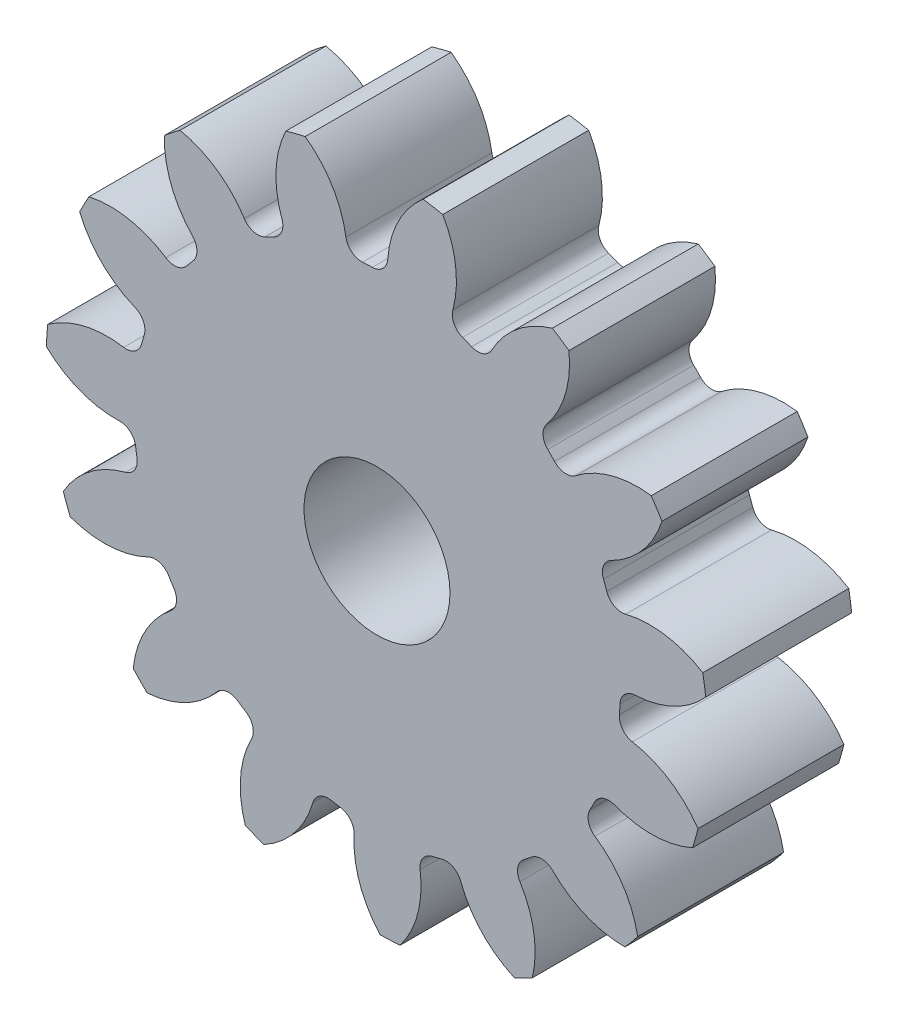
SolidWorks part; units mm, degrees
ref_plane "Front" through (0, 0, 0) normal (0, 0, 1) x (1, 0, 0)
ref_plane "Top" through (0, 0, 0) normal (0, 1, 0) x (1, 0, 0)
ref_plane "Right" through (0, 0, 0) normal (1, 0, 0) x (0, 0, -1)
sketch "Sketch3" plane through (0, 0, 0) normal (0, 0, 1) x (1, 0, 0)
  circle A0 centre (0, 0) radius 287.8667
  dimension "od" = 575.7333
extrude "gearBody" add sketch "Sketch3" along normal blind 127
sketch "Sketch2" plane through (0, 0, 0) normal (0, 0, 1) x (1, 0, 0)
  line L0 (0, 0) -> (220.5133, 91.3396) construction
  line L1 (280.8826, -72.0567) -> (0, 0) construction
  line L2 (0, 0) -> (36.3143, 0) construction
  line L3 (253.8017, 10.0341) -> (250.3432, -42.9451) construction
  line L5 (252.0725, -16.4555) -> (0, 0) construction
  line L7 (0, 0) -> (238.6819, 0) construction
  arc A0 (238.6215, 5.3698) -> (235.8982, -36.3469) centre (0, 0) ccw construction
  arc A1 (285.9957, 32.7669) -> (279.3085, -69.6704) centre (0, 0) ccw construction
  arc A2 (253.8017, 10.0341) -> (250.3432, -42.9451) centre (0, 0) ccw construction
  arc A3 (210.8997, -18.0032) -> (211.4503, -9.5682) centre (0, 0) ccw
  arc A4 (280.8826, -72.0567) -> (222.2105, -32.7446) centre (206.767, -119.2328) ccw
  arc A5 (280.8826, -72.0567) -> (287.8667, 34.9283) centre (0, 0) ccw
  arc A6 (287.8667, 34.9283) -> (224.5817, 3.5777) centre (220.5133, 91.3396) cw
  arc A7 (211.4503, -9.5682) -> (224.5817, 3.5777) centre (225.2199, -10.1913) cw
  arc A8 (222.2105, -32.7446) -> (210.8997, -18.0032) centre (224.6334, -19.1755) cw
  point P6 (287.8667, 34.9283)
  point P22 (280.8826, -72.0567)
  dimension "baseDia" = 477.3639
  dimension "od" = 575.7333
  dimension "pd" = 508
  dimension "rd" = 423.3333
  dimension "rFillet" = 13.7837
  dimension "pointX" = 287.8667
  dimension "pointY" = 34.9283
  dimension "CTT" = 52.9791
  dimension "flankCenterAngle" = 22.5
extrude "toothCut" cut sketch "Sketch2" along normal through all
pattern_circular "CirPattern1" count 15 over 360 about axis through (0, 0, 0) along (0, 0, 1) of "toothCut"
sketch "hub1Dia" plane through (0, 0, 0) normal (0, 0, -1) x (-1, 0, 0)
  circle A0 centre (0, 0) radius 12.7
  dimension "hub1Dia" = 25.4
sketch "hub2Dia" plane through (0, 0, 127) normal (0, 0, 1) x (1, 0, 0)
  circle A0 centre (0, 0) radius 12.7
  dimension "hub2dia" = 25.4
sketch "boreDia" plane through (0, 0, 0) normal (0, 0, 1) x (1, 0, 0)
  circle A0 centre (0, 0) radius 63.5
  dimension "boreDia" = 127
extrude "bore" cut sketch "boreDia" against normal mid plane 25400
